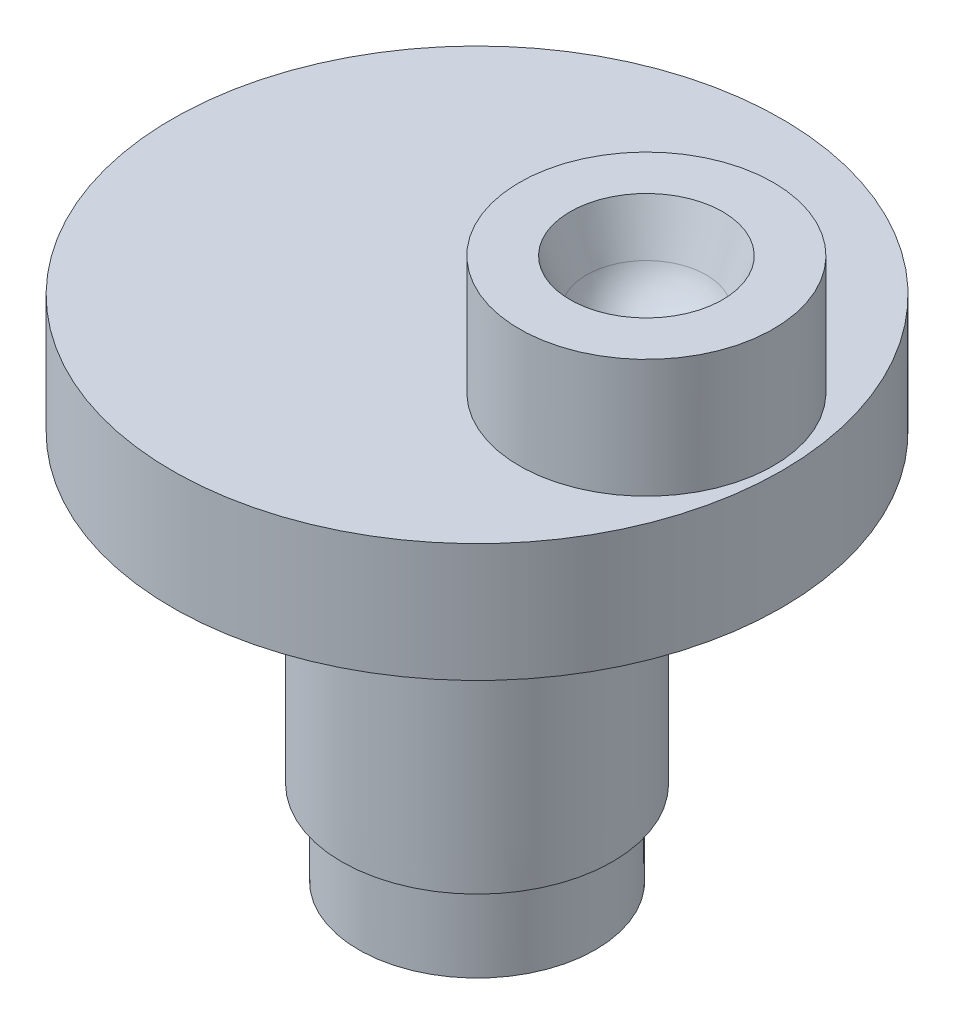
SolidWorks part; units mm, degrees
ref_plane "Plan1" through (0, 0, 0) normal (0, 0, 1) x (1, 0, 0)
ref_plane "Plan2" through (0, 0, 0) normal (0, 1, 0) x (1, 0, 0)
ref_plane "Plan3" through (0, 0, 0) normal (1, 0, 0) x (0, 0, -1)
sketch "Esquisse1" plane through (0, 0, 0) normal (0, 0, 1) x (1, 0, 0)
  line L0 (0, 0) -> (36, 0)
  line L2 (36, 0) -> (36, -14)
  line L4 (36, -14) -> (29.0001, -14)
  line L6 (29.0001, -14) -> (28.7629, -13)
  line L8 (28.7629, -13) -> (15, -13)
  line L9 (15, -13) -> (15, -17)
  line L11 (16.0001, -17) -> (16.0001, -50)
  line L14 (16.0001, -50) -> (14.0001, -50)
  line L16 (14.0001, -50) -> (14.0001, -60)
  line L18 (14.0001, -60) -> (0, -60)
  line L19 (0, -60) -> (0, 0)
  line L20 (15, -17) -> (16.0001, -17)
sketch "Esquisse3" plane through (0, 0, 0) normal (0, 0, 1) x (1, 0, 0)
  line L1 (20, 0) -> (35.0001, 0)
  line L2 (20, 0) -> (20, 3.5)
  line L4 (35.0001, 0) -> (35.0001, 14)
  line L6 (27.0731, 8.5058) -> (29.0105, 14)
  line L7 (29.0105, 14) -> (35.0001, 14)
  arc A0 (20, 3.5) -> (27.0731, 8.5058) centre (20, 11) ccw
  dimension "D1" = 11
revolve "Révolution3" add sketch "Esquisse1" angle 360 about L19
revolve "Révolution4" add sketch "Esquisse3" angle 360 about L2
ref_plane "Plan médian arbre d'entrée" through (0, 0, 0) normal (0, 0, 1) x (1, 0, 0)
